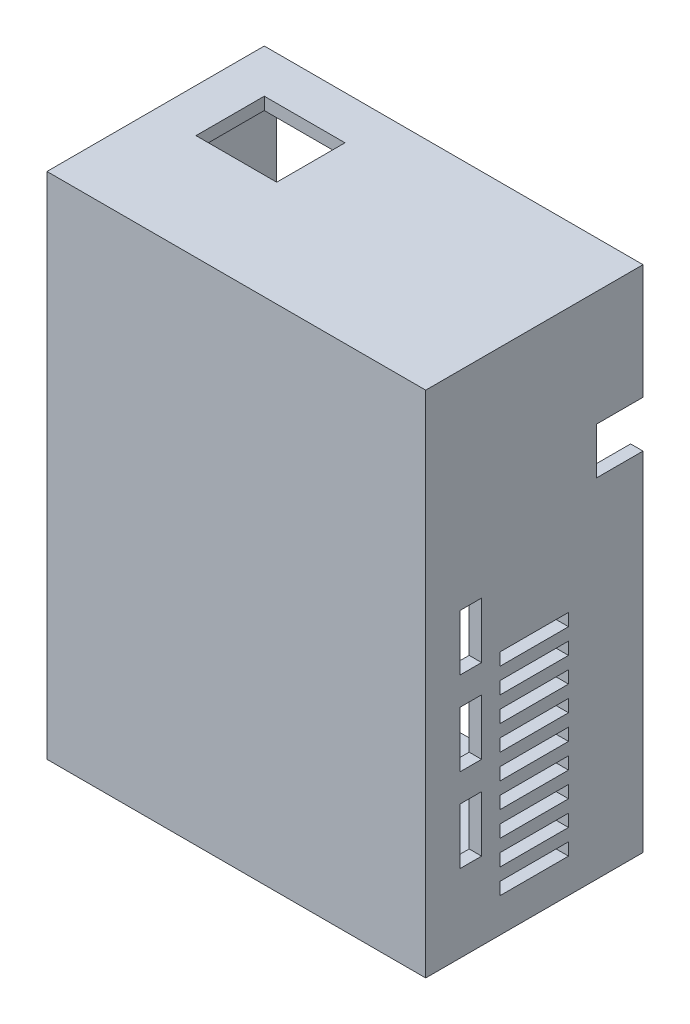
SolidWorks part; units mm, degrees
ref_plane "Alzado" through (0, 0, 0) normal (0, 0, 1) x (1, 0, 0)
ref_plane "Planta" through (0, 0, 0) normal (0, 1, 0) x (1, 0, 0)
ref_plane "Vista lateral" through (0, 0, 0) normal (1, 0, 0) x (0, 0, -1)
sketch "Croquis1" plane through (0, 0, 0) normal (0, 0, 1) x (1, 0, 0)
  line L1 (-64.8461, 56.6347) -> (-3.8461, 56.6347)
  line L2 (-64.8461, 56.6347) -> (-64.8461, -25.3653)
  line L3 (-64.8461, -25.3653) -> (-3.8461, -25.3653)
  line L4 (-3.8461, 56.6347) -> (-3.8461, -25.3653)
  line L5 (-64.8461, 56.6347) -> (-3.8461, -25.3653) construction
  line L6 (-64.8461, -25.3653) -> (-3.8461, 56.6347) construction
  point P0 (-34.3461, 15.6347)
  dimension "D1" = 82
  dimension "D2" = 61
extrude "Saliente-Extruir1" add sketch "Croquis1" along normal blind 35
sketch "Croquis2" plane through (0, 0, 0) normal (0, 0, -1) x (-1, 0, 0)
  line L0 (3.8461, -25.3653) -> (3.8461, 56.6347) construction
  line L1 (5.8461, 54.6347) -> (62.8461, 54.6347)
  line L2 (5.8461, 54.6347) -> (5.8461, -23.3653)
  line L3 (5.8461, -23.3653) -> (62.8461, -23.3653)
  line L4 (62.8461, 54.6347) -> (62.8461, -23.3653)
  line L5 (5.8461, 54.6347) -> (62.8461, -23.3653) construction
  line L6 (5.8461, -23.3653) -> (62.8461, 54.6347) construction
  line L7 (3.8461, 56.6347) -> (64.8461, 56.6347) construction
  point P0 (34.3461, 15.6347)
  dimension "D1" = 78
  dimension "D2" = 57
  dimension "D3" = 2
  dimension "D4" = 2
extrude "Cortar-Extruir1" cut sketch "Croquis2" against normal blind 33
sketch "Croquis3" plane through (0, 0, 0) normal (0, 0, -1) x (-1, 0, 0)
  line L0 (3.8461, 56.6347) -> (64.8461, 56.6347) construction
  line L1 (64.8461, 56.6347) -> (60.8461, 56.6347)
  line L2 (64.8461, 56.6347) -> (64.8461, 52.6347)
  line L3 (64.8461, 52.6347) -> (60.8461, 52.6347)
  line L4 (60.8461, 56.6347) -> (60.8461, 52.6347)
  line L5 (64.8461, 56.6347) -> (60.8461, 52.6347) construction
  line L6 (64.8461, 52.6347) -> (60.8461, 56.6347) construction
  line L7 (64.8461, 56.6347) -> (64.8461, -25.3653) construction
  line L8 (3.8461, -25.3653) -> (3.8461, 56.6347) construction
  line L9 (3.8461, 52.6347) -> (7.8461, 52.6347)
  line L10 (3.8461, 52.6347) -> (3.8461, 56.6347)
  line L11 (3.8461, 56.6347) -> (7.8461, 56.6347)
  line L12 (7.8461, 52.6347) -> (7.8461, 56.6347)
  line L13 (3.8461, 52.6347) -> (7.8461, 56.6347) construction
  line L14 (3.8461, 56.6347) -> (7.8461, 52.6347) construction
  line L15 (64.8461, -25.3653) -> (3.8461, -25.3653) construction
  line L16 (3.8461, -25.3653) -> (7.8461, -25.3653)
  line L17 (3.8461, -25.3653) -> (3.8461, -21.3653)
  line L18 (3.8461, -21.3653) -> (7.8461, -21.3653)
  line L19 (7.8461, -25.3653) -> (7.8461, -21.3653)
  line L20 (3.8461, -25.3653) -> (7.8461, -21.3653) construction
  line L21 (3.8461, -21.3653) -> (7.8461, -25.3653) construction
  line L22 (64.8461, -25.3653) -> (60.8461, -25.3653)
  line L23 (64.8461, -25.3653) -> (64.8461, -21.3653)
  line L24 (64.8461, -21.3653) -> (60.8461, -21.3653)
  line L25 (60.8461, -25.3653) -> (60.8461, -21.3653)
  line L26 (64.8461, -25.3653) -> (60.8461, -21.3653) construction
  line L27 (64.8461, -21.3653) -> (60.8461, -25.3653) construction
  point P0 (62.8461, 54.6347)
  point P9 (5.8461, 54.6347)
  point P16 (5.8461, -23.3653)
  point P21 (62.8461, -23.3653)
  dimension "D1" = 4
  dimension "D2" = 4
  dimension "D3" = 0
  dimension "D4" = 0
  dimension "D5" = 4
  dimension "D6" = 4
  dimension "D7" = 0
  dimension "D8" = 0
  dimension "D9" = 4
  dimension "D10" = 4
  dimension "D11" = 0
  dimension "D12" = 0
  dimension "D13" = 4
  dimension "D14" = 4
  dimension "D15" = 0
  dimension "D16" = 0
extrude "Saliente-Extruir2" add sketch "Croquis3" against normal blind 10
sketch "Croquis4" plane through (0, 0, 33) normal (0, 0, -1) x (-1, 0, 0)
  line L0 (56.8461, -5.3653) -> (56.8461, 44.6347) construction
  line L1 (62.8461, -23.3653) -> (62.8461, 54.6347) construction
  line L2 (5.8461, 54.6347) -> (62.8461, 54.6347) construction
  line L3 (9.3461, 42.1347) -> (59.3461, 42.1347) construction
  line L4 (5.8461, 54.6347) -> (5.8461, -23.3653) construction
  line L5 (59.3461, -5.3653) -> (9.3461, -5.3653) construction
  line L6 (59.3461, -5.3653) -> (59.3461, 44.6347) construction
  line L7 (59.3461, 44.6347) -> (9.3461, 44.6347) construction
  line L8 (9.3461, -5.3653) -> (9.3461, 44.6347) construction
  line L9 (11.8461, -5.3653) -> (11.8461, 44.6347) construction
  line L10 (59.3461, -2.8653) -> (9.3461, -2.8653) construction
  circle A0 centre (56.8461, -2.3653) radius 1.5
  circle A1 centre (11.8461, -2.8653) radius 1.5
  circle A2 centre (56.8461, 42.1347) radius 1.5
  circle A3 centre (11.8461, 42.1347) radius 1.5
  point P21 (56.8461, -2.3653)
  point P22 (11.8461, -2.8653)
  point P23 (11.8461, 42.1347)
  point P24 (56.8461, 42.1347)
  dimension "D1" = 50
  dimension "D2" = 50
  dimension "D3" = 3.5
  dimension "D4" = 50
  dimension "D5" = 3.5
  dimension "D6" = 10
  dimension "D7" = 2.5
  dimension "D8" = 2.5
  dimension "D9" = 2.5
  dimension "D10" = 2.5
extrude "Cortar-Extruir2" cut sketch "Croquis4" against normal blind 1.5
sketch "Croquis5" plane through (0, 0, 33) normal (0, 0, -1) x (-1, 0, 0)
  line L0 (5.8461, 51.1347) -> (61.6498, 51.1347) construction
  line L2 (62.8461, 54.6347) -> (5.8461, 54.6347) construction
  line L3 (62.8461, 33.1347) -> (-9.2086, 33.1347) construction
  line L4 (11.8461, 32.1347) -> (15.8461, 32.1347)
  line L5 (62.8461, 30.1347) -> (5.8461, 30.1347) construction
  line L6 (62.8461, -23.3653) -> (62.8461, 54.6347) construction
  line L7 (5.8461, 54.6347) -> (5.8461, -23.3653) construction
  line L8 (5.8461, 33.1347) -> (62.8461, 51.1347) construction
  line L9 (59.3461, 30.1347) -> (9.3461, 30.1347) construction
  line L10 (59.3461, 30.1347) -> (59.3461, -19.8653) construction
  line L11 (59.3461, -19.8653) -> (9.3461, -19.8653) construction
  line L12 (9.3461, 30.1347) -> (9.3461, -19.8653) construction
  line L13 (56.8461, -17.3653) -> (11.8461, -17.3653) construction
  line L14 (56.8461, -17.3653) -> (56.8461, 27.6347) construction
  line L15 (56.8461, 27.6347) -> (11.8461, 27.6347) construction
  line L16 (11.8461, -17.3653) -> (11.8461, 27.6347) construction
  line L17 (59.3461, -19.8653) -> (54.3461, -19.8653)
  line L18 (59.3461, -19.8653) -> (59.3461, -14.8653)
  line L19 (59.3461, -14.8653) -> (54.3461, -14.8653)
  line L20 (54.3461, -19.8653) -> (54.3461, -14.8653)
  line L21 (59.3461, -19.8653) -> (54.3461, -14.8653) construction
  line L22 (59.3461, -14.8653) -> (54.3461, -19.8653) construction
  line L23 (9.3461, -19.8653) -> (14.3461, -19.8653)
  line L24 (9.3461, -19.8653) -> (9.3461, -14.8653)
  line L25 (9.3461, -14.8653) -> (14.3461, -14.8653)
  line L26 (14.3461, -19.8653) -> (14.3461, -14.8653)
  line L27 (9.3461, -19.8653) -> (14.3461, -14.8653) construction
  line L28 (9.3461, -14.8653) -> (14.3461, -19.8653) construction
  line L29 (9.3461, 30.1347) -> (14.3461, 30.1347)
  line L30 (9.3461, 30.1347) -> (9.3461, 25.1347)
  line L31 (9.3461, 25.1347) -> (14.3461, 25.1347)
  line L32 (14.3461, 30.1347) -> (14.3461, 25.1347)
  line L33 (9.3461, 30.1347) -> (14.3461, 25.1347) construction
  line L34 (9.3461, 25.1347) -> (14.3461, 30.1347) construction
  line L35 (59.3461, 30.1347) -> (54.3461, 30.1347)
  line L36 (59.3461, 30.1347) -> (59.3461, 25.1347)
  line L37 (59.3461, 25.1347) -> (54.3461, 25.1347)
  line L38 (54.3461, 30.1347) -> (54.3461, 25.1347)
  line L39 (59.3461, 30.1347) -> (54.3461, 25.1347) construction
  line L40 (59.3461, 25.1347) -> (54.3461, 30.1347) construction
  line L41 (62.8461, 51.1347) -> (62.8461, 33.1347) construction
  line L42 (62.8461, 33.1347) -> (5.8461, 51.1347) construction
  line L43 (34.3461, 42.1347) -> (34.3461, 33.1347) construction
  line L44 (34.3461, 33.1347) -> (34.3461, 51.1347) construction
  line L45 (12.8461, 33.1347) -> (12.8461, 51.1347) construction
  line L46 (55.8461, 51.1347) -> (55.8461, 33.1347) construction
  line L47 (11.8461, 32.1347) -> (11.8461, 36.1347)
  line L48 (11.8461, 36.1347) -> (15.8461, 36.1347)
  line L49 (15.8461, 32.1347) -> (15.8461, 36.1347)
  line L50 (11.8461, 48.1347) -> (15.8461, 48.1347)
  line L51 (11.8461, 48.1347) -> (11.8461, 52.1347)
  line L52 (11.8461, 52.1347) -> (15.8461, 52.1347)
  line L53 (15.8461, 48.1347) -> (15.8461, 52.1347)
  line L54 (52.8461, 48.1347) -> (56.8461, 48.1347)
  line L55 (52.8461, 48.1347) -> (52.8461, 52.1347)
  line L56 (52.8461, 52.1347) -> (56.8461, 52.1347)
  line L57 (56.8461, 48.1347) -> (56.8461, 52.1347)
  line L58 (52.8461, 36.1347) -> (56.8461, 36.1347)
  line L59 (52.8461, 36.1347) -> (52.8461, 32.1347)
  line L60 (52.8461, 32.1347) -> (56.8461, 32.1347)
  line L61 (56.8461, 36.1347) -> (56.8461, 32.1347)
  line L62 (14.3461, 49.6347) -> (54.3461, 49.6347) construction
  line L63 (14.3461, 49.6347) -> (14.3461, 34.6347) construction
  line L64 (14.3461, 34.6347) -> (54.3461, 34.6347) construction
  line L65 (54.3461, 49.6347) -> (54.3461, 34.6347) construction
  circle A0 centre (56.8461, -17.3653) radius 1
  circle A1 centre (11.8461, -17.3653) radius 1
  circle A2 centre (56.8461, 27.6347) radius 1
  circle A3 centre (11.8461, 27.6347) radius 1
  circle A4 centre (54.3461, 49.6347) radius 0.6
  circle A5 centre (54.3461, 34.6347) radius 0.6
  circle A6 centre (14.3461, 49.6347) radius 0.6
  circle A7 centre (14.3461, 34.6347) radius 0.6
  point P40 (34.3461, 42.1347)
  point P64 (14.3461, 34.6347)
  point P65 (14.3461, 49.6347)
  dimension "D41" = 2
  dimension "D42" = 2
  dimension "D43" = 2
  dimension "D44" = 2
  dimension "D50" = 1.2
  dimension "D51" = 1.2
  dimension "D52" = 1.2
  dimension "D53" = 1.2
  dimension "D1" = 3.5
  dimension "D2" = 18
  dimension "D3" = 3
  dimension "D4" = 50
  dimension "D5" = 50
  dimension "D6" = 3.5
  dimension "D7" = 3.5
  dimension "D8" = 2.5
  dimension "D9" = 2.5
  dimension "D10" = 2.5
  dimension "D11" = 2.5
  dimension "D12" = 5
  dimension "D13" = 5
  dimension "D14" = 5
  dimension "D15" = 5
  dimension "D16" = 5
  dimension "D17" = 5
  dimension "D18" = 5
  dimension "D19" = 5
  dimension "D20" = 21.5
  dimension "D21" = 21.5
  dimension "D22" = 1
  dimension "D23" = 1
  dimension "D24" = 4
  dimension "D25" = 4
  dimension "D26" = 1
  dimension "D27" = 1
  dimension "D28" = 4
  dimension "D29" = 4
  dimension "D30" = 1
  dimension "D31" = 1
  dimension "D32" = 4
  dimension "D33" = 4
  dimension "D34" = 1
  dimension "D35" = 1
  dimension "D36" = 4
  dimension "D37" = 4
  dimension "D38" = 1.5
  dimension "D39" = 15
  dimension "D40" = 1.5
  dimension "D45" = 1.5
  dimension "D46" = 1.5
  dimension "D47" = 1.5
  dimension "D48" = 15
  dimension "D49" = 1.5
extrude "Saliente-Extruir3" add sketch "Croquis5" along normal blind 4
sketch "Croquis7" plane through (0, 0, 0) normal (0, 0, -1) x (-1, 0, 0)
  line L0 (7.8461, -21.3653) -> (3.8461, -25.3653) construction
  line L1 (3.8461, -25.3653) -> (7.8461, -25.3653) construction
  line L2 (64.8461, -25.3653) -> (3.8461, -25.3653) construction
  line L3 (7.8461, -25.3653) -> (7.8461, -21.3653) construction
  line L4 (7.8461, -21.3653) -> (3.8461, -21.3653) construction
  line L5 (3.8461, -25.3653) -> (3.8461, 56.6347) construction
  line L6 (3.8461, -21.3653) -> (7.8461, -25.3653) construction
  line L8 (7.8461, 52.6347) -> (5.3461, 52.6347) construction
  line L9 (5.8461, 52.6347) -> (7.8461, 52.6347) construction
  line L10 (5.3461, 52.6347) -> (5.3461, 55.1347) construction
  line L11 (5.3461, 55.1347) -> (7.8461, 55.1347) construction
  line L12 (7.8461, 52.6347) -> (7.8461, 54.6347) construction
  line L13 (7.8461, 55.1347) -> (5.3461, 52.6347) construction
  line L14 (5.3461, 52.6347) -> (7.8461, 52.6347) construction
  line L15 (7.8461, 52.6347) -> (5.3461, 55.1347) construction
  circle A0 centre (5.8461, -23.3653) radius 1
  point P10 (5.8461, -23.3653)
  dimension "D1" = 2
extrude "Cortar-Extruir3" cut sketch "Croquis7" against normal blind 6
sketch "Croquis9" plane through (0, 0, 33) normal (0, 0, -1) x (-1, 0, 0)
  line L0 (3.8461, -15.3653) -> (68.4902, -15.3653) construction
  line L1 (3.8461, -25.3653) -> (3.8461, 56.6347) construction
  line L2 (7.8461, -23.3653) -> (60.8461, -23.3653) construction
  line L3 (5.8461, 9.6347) -> (62.8461, 9.6347) construction
  line L4 (5.8461, 52.6347) -> (5.8461, -21.3653) construction
  line L5 (62.8461, -21.3653) -> (62.8461, 52.6347) construction
  line L6 (5.8461, 20.1347) -> (78.2307, 20.1347) construction
  line L7 (54.3461, 25.1347) -> (59.3461, 25.1347) construction
  dimension "D1" = 8
  dimension "D2" = 25
  dimension "D3" = 5
sketch "Croquis10" plane through (0, 0, 0) normal (0, 0, -1) x (-1, 0, 0)
  line L0 (64.8461, -25.3653) -> (60.8461, -21.3653) construction
  line L1 (60.8461, -21.3653) -> (64.8461, -21.3653) construction
  line L2 (64.8461, 56.6347) -> (64.8461, -25.3653) construction
  line L3 (64.8461, -21.3653) -> (60.8461, -25.3653) construction
  line L4 (64.8461, -25.3653) -> (3.8461, -25.3653) construction
  line L5 (60.8461, 52.6347) -> (64.8461, 56.6347) construction
  line L6 (64.8461, 56.6347) -> (64.8461, 52.6347) construction
  line L7 (64.8461, 52.6347) -> (60.8461, 56.6347) construction
  line L8 (3.8461, 56.6347) -> (64.8461, 56.6347) construction
  line L9 (7.8461, 52.6347) -> (3.8461, 56.6347) construction
  line L10 (3.8461, -25.3653) -> (3.8461, 56.6347) construction
  line L11 (3.8461, 56.6347) -> (7.8461, 56.6347) construction
  line L12 (7.8461, 56.6347) -> (3.8461, 52.6347) construction
  circle A0 centre (62.8461, -23.3653) radius 1
  circle A1 centre (5.8461, 54.6347) radius 1
  circle A2 centre (62.8461, 54.6347) radius 1
  point P7 (62.8461, -23.3653)
  point P17 (62.8461, 54.6347)
  point P29 (5.8461, 54.6347)
  dimension "D1" = 2
  dimension "D2" = 2
  dimension "D3" = 2
extrude "Cortar-Extruir4" cut sketch "Croquis10" against normal blind 6
sketch "Croquis11" plane through (-64.8461, 0, 0) normal (-1, 0, 0) x (0, 0, 1)
  line L0 (0, -15.3653) -> (34.0915, -15.3653) construction
  line L1 (0, 56.6347) -> (0, -25.3653) construction
  line L2 (35, -25.3653) -> (0, -25.3653) construction
  line L3 (0, 1.6347) -> (35, 1.6347) construction
  line L4 (35, 56.6347) -> (35, -25.3653) construction
  line L5 (0, 8.6347) -> (35, 8.6347) construction
  line L6 (7, 1.6347) -> (7, 8.6347) construction
  line L7 (7, 1.6347) -> (0, 1.6347)
  line L8 (0, 1.6347) -> (0, 8.6347)
  line L9 (0, 8.6347) -> (7, 8.6347)
  line L10 (7, 8.6347) -> (7, 1.6347)
  dimension "D1" = 10
  dimension "D2" = 17
  dimension "D3" = 7
  dimension "D4" = 7
extrude "Cortar-Extruir8" cut sketch "Croquis11" against normal blind 6
sketch "Croquis12" plane through (-3.8461, 0, 0) normal (1, 0, 0) x (0, 0, -1)
  line L0 (-7.5, 56.6347) -> (-7.5, -24.4809) construction
  line L1 (-35, 56.6347) -> (0, 56.6347) construction
  line L2 (-35, -25.3653) -> (-35, 56.6347) construction
  line L3 (-0.5, 56.6347) -> (-0.5, -25.3653) construction
  line L4 (-35, -25.3653) -> (0, -25.3653) construction
  dimension "D1" = 27.5
  dimension "D2" = 7
ref_plane "Plano1" through (-59.3461, 25.1347, 33) normal (-1, 0, 0) x (0, 0, 1)
ref_plane "Plano2" through (-14.3461, 25.1347, 33) normal (-1, 0, 0) x (0, 0, 1)
sketch "Croquis15" plane through (0, 0, 33) normal (0, 0, -1) x (-1, 0, 0)
  line L0 (9.3461, 25.1347) -> (14.3461, 25.1347) construction
sketch "Croquis16" plane through (-3.8461, 0, 0) normal (1, 0, 0) x (0, 0, -1)
  line L0 (-26.97, 20.1347) -> (0, 20.1347) construction
  line L1 (0, -25.3653) -> (0, 56.6347) construction
  line L2 (-35, 56.6347) -> (0, 56.6347) construction
  line L3 (0, 30.6347) -> (-16.7512, 30.6347) construction
  line L4 (0, 38.1347) -> (-17.6227, 38.1347) construction
  line L5 (0, 38.1347) -> (0, 30.6347)
  line L6 (0, 30.6347) -> (-7.4974, 30.6347)
  line L7 (-7.4974, 30.6347) -> (-7.4974, 38.1347)
  line L8 (-7.4974, 38.1347) -> (0, 38.1347)
  dimension "D1" = 36.5
  dimension "D2" = 10.5
  dimension "D3" = 7.5
extrude "Cortar-Extruir9" cut sketch "Croquis16" against normal blind 6
sketch "Croquis17" plane through (-64.8461, 0, 0) normal (-1, 0, 0) x (0, 0, 1)
  line L0 (33, -23.3653) -> (33, 54.6347) construction
  line L1 (33, 54.6347) -> (33, -23.3653) construction
  line L2 (33, -23.3653) -> (1.8861, -23.3653) construction
  line L3 (10, -23.3653) -> (0, -23.3653) construction
  line L4 (23, -23.3653) -> (23, 36.0783) construction
  line L5 (12, -23.3653) -> (12, 18.3473) construction
  line L6 (7.5, 56.6347) -> (7.5, -24.4809) construction
  line L7 (29, -19.8653) -> (6.385, -19.8653) construction
  line L8 (23, -13.8653) -> (12, -13.8653)
  line L9 (23, -19.8653) -> (12, -19.8653)
  line L10 (23, -19.8653) -> (23, -17.8653)
  line L11 (23, -17.8653) -> (12, -17.8653)
  line L12 (12, -19.8653) -> (12, -17.8653)
  line L13 (23, -15.8653) -> (12, -15.8653)
  line L14 (12, -15.8653) -> (12, -13.8653)
  line L15 (23, -15.8653) -> (23, -13.8653)
  line L16 (23, -9.8653) -> (12, -9.8653)
  line L17 (23, -11.8653) -> (12, -11.8653)
  line L18 (12, -11.8653) -> (12, -9.8653)
  line L19 (23, -11.8653) -> (23, -9.8653)
  line L20 (23, -5.8653) -> (12, -5.8653)
  line L21 (23, -7.8653) -> (12, -7.8653)
  line L22 (12, -7.8653) -> (12, -5.8653)
  line L23 (23, -7.8653) -> (23, -5.8653)
  line L24 (23, -1.8653) -> (12, -1.8653)
  line L25 (23, -3.8653) -> (12, -3.8653)
  line L26 (12, -3.8653) -> (12, -1.8653)
  line L27 (23, -3.8653) -> (23, -1.8653)
  line L28 (23, 2.1347) -> (12, 2.1347)
  line L29 (23, 0.1347) -> (12, 0.1347)
  line L30 (12, 0.1347) -> (12, 2.1347)
  line L31 (23, 0.1347) -> (23, 2.1347)
  line L32 (23, 6.1347) -> (12, 6.1347)
  line L33 (23, 4.1347) -> (12, 4.1347)
  line L34 (12, 4.1347) -> (12, 6.1347)
  line L35 (23, 4.1347) -> (23, 6.1347)
  line L36 (23, 10.1347) -> (12, 10.1347)
  line L37 (23, 8.1347) -> (12, 8.1347)
  line L38 (12, 8.1347) -> (12, 10.1347)
  line L39 (23, 8.1347) -> (23, 10.1347)
  line L40 (23, 14.1347) -> (12, 14.1347)
  line L41 (23, 12.1347) -> (12, 12.1347)
  line L42 (12, 12.1347) -> (12, 14.1347)
  line L43 (23, 12.1347) -> (23, 14.1347)
  point P17 (23, -19.8653)
  dimension "D1" = 10
  dimension "D2" = 11
  dimension "D3" = 4.5
  dimension "D4" = 2
  dimension "D5" = 9
extrude "Cortar-Extruir10" cut sketch "Croquis17" against normal blind 70
sketch "Croquis18" plane through (0, -25.3653, 0) normal (0, -1, 0) x (1, 0, 0)
  line L0 (-64.8461, 15) -> (-3.8461, 15) construction
  line L1 (-64.8461, 35) -> (-64.8461, 0) construction
  line L2 (-3.8461, 35) -> (-3.8461, 0) construction
  line L3 (-64.8461, 0) -> (-3.8461, 0) construction
  line L4 (-64.4984, 21) -> (3.5893, 21) construction
  line L5 (-64.8461, 35) -> (-3.8461, 35) construction
  line L6 (-64.8461, 15) -> (-3.8461, 21) construction
  line L7 (-3.8461, 21) -> (-3.8461, 15) construction
  line L8 (-3.8461, 15) -> (-64.4984, 21) construction
  line L9 (-64.8461, 33) -> (-3.8461, 33) construction
  line L10 (-30.3461, 15) -> (-38.3461, 15)
  line L11 (-30.3461, 15) -> (-30.3461, 21)
  line L12 (-30.3461, 21) -> (-38.3461, 21)
  line L13 (-38.3461, 15) -> (-38.3461, 21)
  line L14 (-30.3461, 15) -> (-38.3461, 21) construction
  line L15 (-30.3461, 21) -> (-38.3461, 15) construction
  line L16 (-64.8461, 29) -> (-3.8461, 29) construction
  line L17 (-58.8461, 33) -> (-58.8461, 29) construction
  line L18 (-51.3461, 29) -> (-51.3461, 33) construction
  line L19 (-41.3461, 33) -> (-41.3461, 21) construction
  line L21 (-41.3461, 21) -> (-51.3461, 21)
  line L22 (-41.3461, 21) -> (-41.3461, 29)
  line L23 (-41.3461, 29) -> (-51.3461, 29)
  line L24 (-51.3461, 21) -> (-51.3461, 29)
  line L25 (-14.8461, 7) -> (-10.8461, 7)
  line L26 (-14.8461, 7) -> (-14.8461, 11)
  line L27 (-14.8461, 11) -> (-10.8461, 11)
  line L28 (-10.8461, 7) -> (-10.8461, 11)
  line L29 (-14.8461, 7) -> (-10.8461, 11) construction
  line L30 (-14.8461, 11) -> (-10.8461, 7) construction
  point P12 (-34.3461, 18)
  point P28 (-12.8461, 9)
  dimension "D1" = 15
  dimension "D2" = 6
  dimension "D3" = 14
  dimension "D4" = 8
  dimension "D5" = 2
  dimension "D6" = 4
  dimension "D7" = 6
  dimension "D8" = 7.5
  dimension "D9" = 10
  dimension "D10" = 4
  dimension "D11" = 8
  dimension "D12" = 4
  dimension "D13" = 7
  dimension "D14" = 7
extrude "Cortar-Extruir11" cut sketch "Croquis18" against normal blind 7
sketch "Croquis19" plane through (0, -25.3653, 0) normal (0, -1, 0) x (1, 0, 0)
sketch "Croquis20" plane through (0, 56.6347, 0) normal (0, 1, 0) x (-1, 0, 0)
  line L1 (57.8461, 7) -> (44.8461, 7)
  line L2 (57.8461, 7) -> (57.8461, 18)
  line L3 (57.8461, 18) -> (44.8461, 18)
  line L4 (44.8461, 7) -> (44.8461, 18)
  line L5 (57.8461, 7) -> (44.8461, 18) construction
  line L6 (57.8461, 18) -> (44.8461, 7) construction
  line L7 (3.8461, 35) -> (64.8461, 35) construction
  line L9 (64.8461, 35) -> (64.8461, 0) construction
  point P0 (51.3461, 12.5)
  dimension "D1" = 13
  dimension "D2" = 11
  dimension "D3" = 7
  dimension "D4" = 17
extrude "Cortar-Extruir12" cut sketch "Croquis20" against normal blind 10
sketch "Croquis21" plane through (-3.8461, 0, 0) normal (1, 0, 0) x (0, 0, -1)
  line L0 (-29.5, -25.3653) -> (-29.5, -13.6084) construction
  line L2 (-35, -25.3653) -> (-35, 56.6347) construction
  line L3 (-35, -19.8653) -> (-9.7642, -19.8653) construction
  line L4 (-35, -25.3653) -> (0, -25.3653) construction
  line L5 (-26, -25.3653) -> (-26, -15.1837) construction
  line L6 (-29.5, -12.8653) -> (-26, -12.8653) construction
  line L7 (-29.5, -3.8653) -> (-26, -3.8653) construction
  line L9 (-26, -12.8653) -> (-29.5, -12.8653)
  line L10 (-26, -12.8653) -> (-26, -3.8653)
  line L11 (-26, -3.8653) -> (-29.5, -3.8653)
  line L12 (-29.5, -12.8653) -> (-29.5, -3.8653)
  line L13 (-29.5, 0.6347) -> (-26, 0.6347)
  line L14 (-29.5, 0.6347) -> (-29.5, 9.6347)
  line L15 (-29.5, 9.6347) -> (-26, 9.6347)
  line L16 (-26, 0.6347) -> (-26, 9.6347)
  line L17 (-29.5, 14.1347) -> (-26, 14.1347)
  line L18 (-29.5, 14.1347) -> (-29.5, 23.1347)
  line L19 (-29.5, 23.1347) -> (-26, 23.1347)
  line L20 (-26, 14.1347) -> (-26, 23.1347)
  dimension "D1" = 5.5
  dimension "D2" = 5.5
  dimension "D3" = 3.5
  dimension "D4" = 7
  dimension "D5" = 9
  dimension "D6" = 20.5
  dimension "D7" = 9
  dimension "D8" = 34
  dimension "D9" = 9
extrude "Cortar-Extruir13" cut sketch "Croquis21" against normal blind 2
